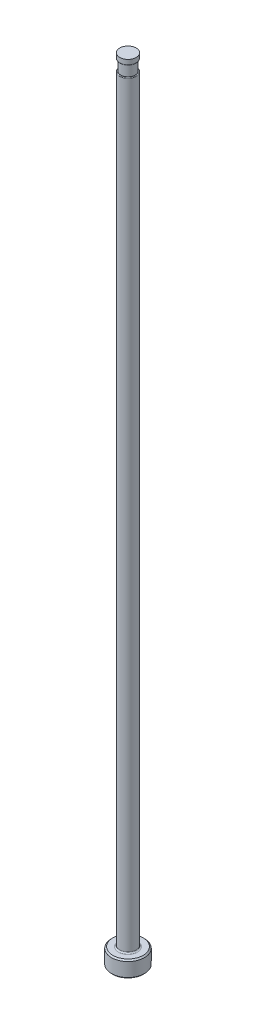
SolidWorks part; units mm, degrees
ref_plane "Front Plane" through (0, 0, 0) normal (0, 0, 1) x (1, 0, 0)
ref_plane "Top Plane" through (0, 0, 0) normal (0, 1, 0) x (1, 0, 0)
ref_plane "Right Plane" through (0, 0, 0) normal (1, 0, 0) x (0, 0, -1)
other "Configuration Table"
sketch "Sketch1" plane through (0, 0, 0) normal (0, 0, 1) x (1, 0, 0)
  line L0 (0, 259.9588) -> (0, -15.1925) construction
  line L1 (0, 0) -> (-3.175, 0)
  line L2 (-3.175, 0) -> (-3.175, 3.175)
  line L3 (-3.175, 3.175) -> (-1.5875, 3.175)
  line L4 (-1.5875, 3.175) -> (-1.5875, 152.4)
  line L5 (-1.5875, 152.4) -> (0, 152.4)
  line L6 (0, 152.4) -> (0, 0)
  dimension "L" = 152.4
  dimension "H" = 6.35
  dimension "T" = 3.175
  dimension "D" = 3.175
revolve "Revolve1" add sketch "Sketch1" angle 360 about L0
chamfer "Chamfer1" distance 0.254 angle 45 2 edges at (0, 3.175, 3.175) (0, 0, 3.175)
fillet "Fillet1" radius 0.254 1 edges at (0, 3.175, 1.5875)
sketch "Sketch2" plane through (0, 0, 0) normal (0, 0, 1) x (1, 0, 0)
  line L0 (-1.5875, 152.4) -> (-1.5875, 3.429) construction
  line L1 (-1.5875, 151.384) -> (-1.3843, 151.384)
  line L2 (-1.5875, 151.384) -> (-1.5875, 149.352)
  line L3 (-1.5875, 149.352) -> (-1.3843, 149.352)
  line L4 (-1.3843, 151.384) -> (-1.3843, 149.352)
  line L5 (1.5875, 152.4) -> (-1.5875, 152.4) construction
  line L6 (0, 153.4483) -> (0, 147.3282) construction
  dimension "D1" = 2.032
  dimension "N" = 1.016
  dimension "FD" = 0.2032
  dimension "D3" = 2.7686
revolve "Vent Relief" cut sketch "Sketch2" angle 360 about L6
sketch "Sketch3" plane through (0, 0, 0) normal (0, 0, 1) x (1, 0, 0)
  line L0 (-1.3843, 150.368) -> (-1.3843, 86.868)
  line L1 (-1.3843, 151.384) -> (-1.3843, 149.352) construction
  line L2 (-1.5875, 149.352) -> (-1.5875, 3.429) construction
  line L3 (-1.5875, 85.7504) -> (-1.5875, 150.368)
  line L4 (-1.5875, 150.368) -> (-1.3843, 150.368)
  arc A0 (-1.3843, 86.868) -> (-1.5875, 85.7504) centre (-4.5593, 86.868) cw
  dimension "D1" = 3.175
  dimension "D2" = 63.5
extrude "D-Slot" cut sketch "Sketch3" against normal through all both and the other way through all
sketch "Sketch5" plane through (0, 0, 0) normal (0, 0, 1) x (1, 0, 0)
  line L0 (-1.5875, 151.384) -> (1.5875, 151.384) construction
  line L1 (-1.5875, 152.4) -> (-1.5824, 152.4)
  line L2 (-1.5875, 152.4) -> (-1.5875, 151.384)
  line L3 (-1.5875, 151.384) -> (-1.5824, 151.384)
  line L4 (-1.5824, 152.4) -> (-1.5824, 151.384)
  line L5 (0, 152.6877) -> (0, 150.5771) construction
  dimension "VP" = 0.0051
revolve "Vent Diameter" cut sketch "Sketch5" angle 360 about L5
fillet "Fillet2" radius 0.127 2 edges at (1.5875, 149.352, 0) (0, 151.384, 1.5824)
sketch "Pocket Sketch" plane through (0, 0, 0) normal (0, 0, 1) x (1, 0, 0)
  line L0 (-3.5719, 0) -> (-3.5719, 3.2004)
  line L1 (-3.5719, 3.2004) -> (-2.5479, 3.2004)
  line L2 (-1.7859, 3.9624) -> (-1.7859, 22.225)
  line L3 (-1.7859, 22.225) -> (0, 22.225)
  line L4 (0, 22.225) -> (0, 0)
  line L5 (0, 0) -> (-3.5719, 0)
  line L6 (0, 12.6104) -> (0, -2.4989) construction
  line L7 (-3.175, 2.921) -> (-3.175, 0.254) construction
  line L8 (2.921, 3.175) -> (-2.921, 3.175) construction
  line L9 (-1.5875, 85.7504) -> (-1.5875, 3.429) construction
  line L10 (-2.5479, 3.2004) -> (-1.7859, 3.9624)
  point P3 (-1.7859, 3.2004)
  dimension "D1" = 7.1437
  dimension "D2" = 0.3969
  dimension "D3" = 0.0254
  dimension "D4" = 0.1984
  dimension "D5" = 3.5719
  dimension "D6" = 22.225
